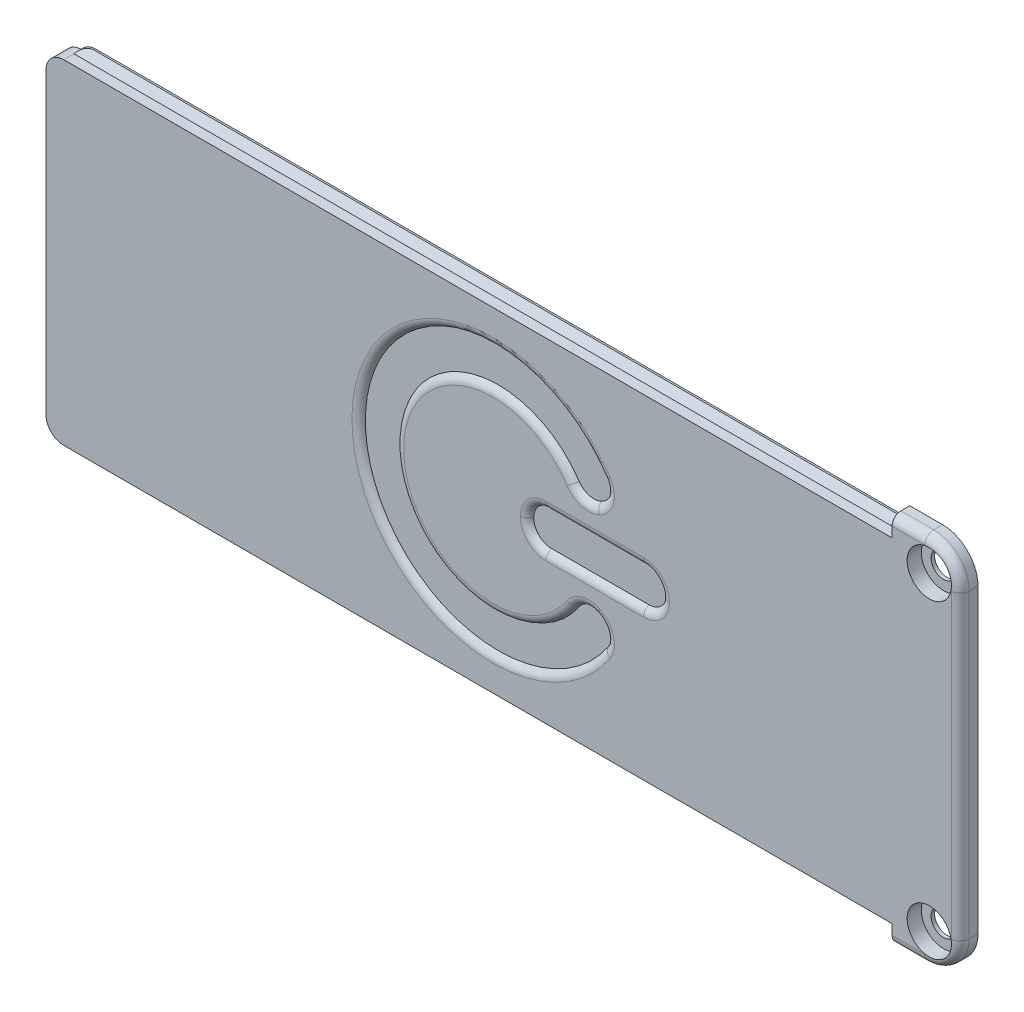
SolidWorks part; units mm, degrees
ref_plane "Plan de face" through (0, 0, 0) normal (0, 0, 1) x (1, 0, 0)
ref_plane "Plan de dessus" through (0, 0, 0) normal (0, 1, 0) x (1, 0, 0)
ref_plane "Plan de droite" through (0, 0, 0) normal (1, 0, 0) x (0, 0, -1)
sketch "Esquisse1" plane through (0, 0, 0) normal (0, 0, 1) x (1, 0, 0)
  line L0 (95.5, 37.7) -> (95.5, 39.85)
  line L1 (0, 0) -> (95.5, 0)
  line L2 (0, 0) -> (0, 37.7)
  line L3 (0, 37.7) -> (95.5, 37.7)
  line L5 (103.2, -2.15) -> (95.5, -2.15)
  line L6 (103.2, -2.15) -> (103.2, 39.85)
  line L7 (103.2, 39.85) -> (95.5, 39.85)
  line L8 (95.5, -2.15) -> (95.5, 0)
  dimension "D1" = 103.2
  dimension "D2" = 37.7
  dimension "D3" = 42
  dimension "D4" = 7.7
  dimension "D5" = 2.15
extrude "Boss.-Extru.1" add sketch "Esquisse1" along normal blind 2
sketch "Esquisse4" plane through (0, 0, 2) normal (0, 0, 1) x (1, 0, 0)
  line L0 (7.471, 18.85) -> (93.429, 18.85) construction
  line L3 (50.45, 18.85) -> (70.3888, 28.1476) construction
  line L5 (50.45, 35.4137) -> (50.45, -6.5863) construction
  line L7 (70.3888, 28.1476) -> (70.3888, 9.5524) construction
  line L8 (70.3888, 9.5524) -> (50.45, 18.85) construction
  line L9 (60.4194, 23.4988) -> (64.0446, 25.1893)
  line L10 (60.4194, 14.2012) -> (64.0446, 12.5107)
  line L11 (95.5, 37.7) -> (0, 37.7) construction
  line L12 (103.2, -2.15) -> (103.2, 39.85) construction
  line L13 (54.45, 20.85) -> (69.45, 20.85)
  line L14 (54.45, 20.85) -> (54.45, 16.85)
  line L15 (54.45, 16.85) -> (69.45, 16.85)
  line L16 (69.45, 20.85) -> (69.45, 16.85)
  arc A0 (64.0446, 25.1893) -> (64.0446, 12.5107) centre (50.45, 18.85) ccw
  arc A1 (60.4194, 23.4988) -> (60.4194, 14.2012) centre (50.45, 18.85) ccw
  dimension "D1" = 30
  dimension "D2" = 22
  dimension "D3" = 25
  dimension "D4" = 25
  dimension "D5" = 4
  dimension "D6" = 2
  dimension "D7" = 15
  dimension "D8" = 4
  dimension "D9" = 18.85
  dimension "D10" = 52.75
  dimension "D11" = 52.75
extrude "Enlèv. mat.-Extru.1" cut sketch "Esquisse4" against normal blind 0.6
fillet "Congé8" radius 2 8 edges at (54.45, 20.85, 1.7) (60.4194, 23.4988, 1.7) (64.0446, 25.1893, 1.7) (69.45, 20.85, 1.7) (69.45, 16.85, 1.7) (54.45, 16.85, 1.7) (60.4194, 14.2012, 1.7) (64.0446, 12.5107, 1.7)
fillet "Congé9" radius 1 12 edges at (55.0358, 17.4358, 2) (55.0358, 20.2642, 2) (61.95, 20.85, 2) (68.8642, 20.2642, 2) (68.8642, 17.4358, 2) (63.1731, 25.5542, 2) (60.7095, 24.1647, 2) (39.45, 18.85, 2) (60.7095, 13.5353, 2) (63.1731, 12.1458, 2) (61.95, 16.85, 2) (35.45, 18.85, 2)
sketch "Esquisse5" plane through (0, 0, 2) normal (0, 0, 1) x (1, 0, 0)
  line L0 (99.7, 53.0127) -> (99.7, -7.4784) construction
  line L1 (109.857, 1.35) -> (86.4411, 1.35) construction
  line L3 (107.9057, 36.35) -> (86.4411, 36.35) construction
  line L6 (103.2, -2.15) -> (103.2, 39.85) construction
  line L7 (95.5, -2.15) -> (103.2, -2.15) construction
  line L9 (103.2, 39.85) -> (95.5, 39.85) construction
  circle A0 centre (99.7, 1.35) radius 1.4
  circle A1 centre (99.7, 36.35) radius 1.4
  dimension "D4" = 2.8
  dimension "D5" = 2.8
  dimension "D1" = 3.5
  dimension "D2" = 3.5
  dimension "D3" = 3.5
extrude "Enlèv. mat.-Extru.2" cut sketch "Esquisse5" against normal blind 10
fillet "Congé10" radius 4 2 edges at (103.2, 39.85, 1) (103.2, -2.15, 1)
fillet "Congé11" radius 1 5 edges at (97.35, 39.85, 2) (102.0284, 38.6784, 2) (103.2, 18.85, 2) (102.0284, -0.9784, 2) (97.35, -2.15, 2)
sketch "Esquisse6" plane through (0, 0, 2) normal (0, 0, 1) x (1, 0, 0)
  circle A0 centre (99.7, 1.35) radius 2.5
  circle A1 centre (99.7, 36.35) radius 2.5
  dimension "D1" = 5
  dimension "D2" = 5
extrude "Enlèv. mat.-Extru.3" cut sketch "Esquisse6" against normal blind 1.6
fillet "Congé13" radius 2 2 edges at (0, 0, 1) (0, 37.7, 1)
sketch "Esquisse7" plane through (95.5, 0, 0) normal (-1, 0, 0) x (0, 0, 1)
  line L0 (0, 37.7) -> (0, 38.55)
  line L2 (0, 38.55) -> (0.2, 38.55)
  line L3 (0.2, 38.55) -> (0.85, 37.7)
  line L4 (2, 37.7) -> (0, 37.7) construction
  line L5 (0.85, 37.7) -> (0, 37.7)
  line L6 (0, 39.85) -> (0, 37.7) construction
  line L7 (0, 0) -> (0, -0.85)
  line L8 (0, 0) -> (0, -2.15) construction
  line L9 (0, -0.85) -> (0.2, -0.85)
  line L10 (0.2, -0.85) -> (0.85, 0)
  line L11 (2, 0) -> (0, 0) construction
  line L12 (0.85, 0) -> (0, 0)
  dimension "D1" = 0.85
  dimension "D2" = 0.2
  dimension "D3" = 0.85
  dimension "D4" = 0.2
  dimension "D5" = 0.85
  dimension "D6" = 0.85
extrude "Boss.-Extru.2" add sketch "Esquisse7" along normal up to vertex (95.5 mm away)
fillet "Congé14" radius 2 2 edges at (2, -0.85, 0.1) (2, 38.55, 0.1)
ref_plane "Plan1" through (0, 2, 0) normal (0, -1, 0) x (-1, 0, 0)
sketch "Esquisse10" plane through (0, 2, 0) normal (0, -1, 0) x (-1, 0, 0)
  line L0 (0, 0) -> (0, -0.85)
  line L2 (0, -0.85) -> (0.85, -0.2)
  line L3 (0.85, -0.2) -> (0.85, 0)
  line L4 (0.85, 0) -> (0, 0)
  line L5 (0, 0) -> (0, -2) construction
  dimension "D1" = 0.85
  dimension "D2" = 0.2
  dimension "D3" = 0.85
extrude "Boss.-Extru.3" add sketch "Esquisse10" against normal up to vertex
fillet "Congé15" radius 2 2 edges at (-0.85, 2, 0.1) (-0.85, 35.7, 0.1)
sketch "Esquisse9" plane through (0, 0, 0) normal (0, 0, -1) x (-1, 0, 0)
  line L0 (-95.5, 37.7) -> (0, 37.7) construction
  line L1 (-24.5, 30.7) -> (-16.5, 30.7)
  line L2 (-24.5, 30.7) -> (-24.5, 22.7)
  line L3 (-24.5, 22.7) -> (-16.5, 22.7)
  line L4 (-16.5, 30.7) -> (-16.5, 22.7)
  dimension "D1" = 8
  dimension "D2" = 8
  dimension "D3" = 16.5
  dimension "D4" = 7
extrude "Enlèv. mat.-Extru.4" cut sketch "Esquisse9" against normal blind 1.6
